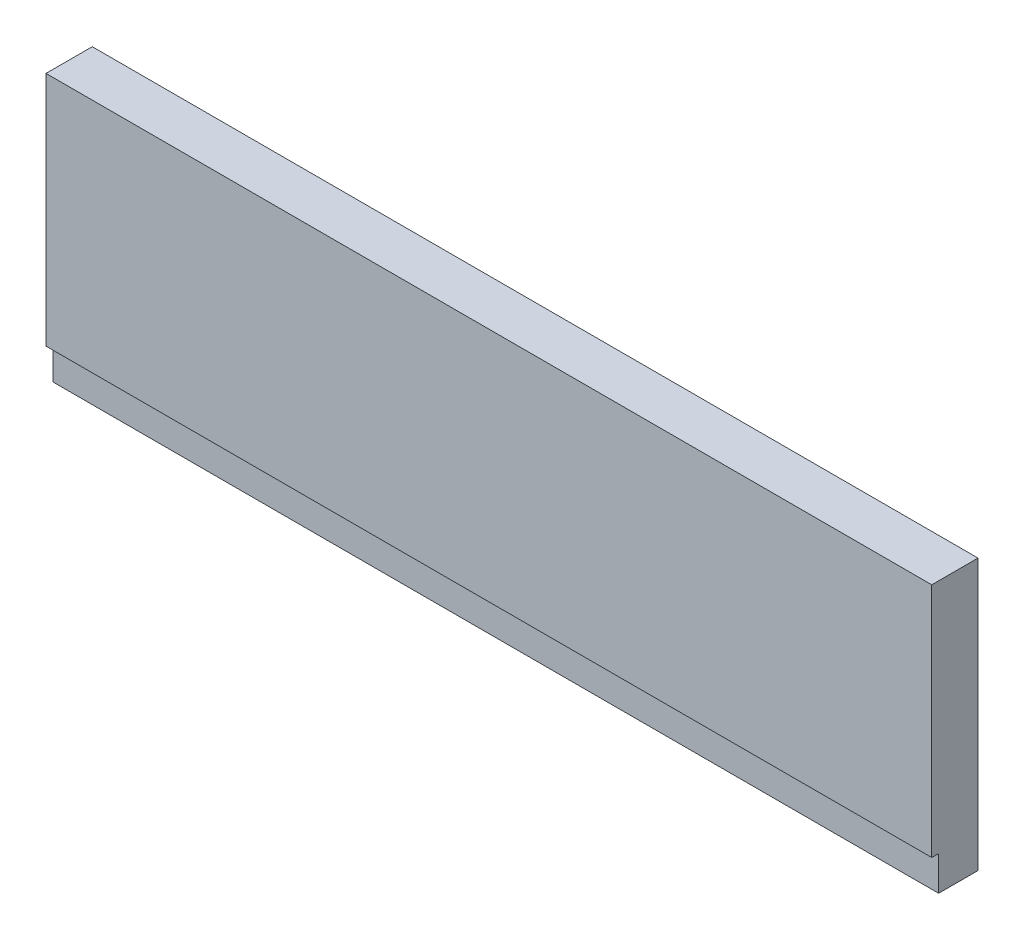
SolidWorks part; units mm, degrees
ref_plane "Спереди" through (0, 0, 0) normal (0, 0, 1) x (1, 0, 0)
ref_plane "Сверху" through (0, 0, 0) normal (0, 1, 0) x (1, 0, 0)
ref_plane "Справа" through (0, 0, 0) normal (1, 0, 0) x (0, 0, -1)
sketch "Эскиз1" plane through (0, 0, 0) normal (0, 0, 1) x (1, 0, 0)
  line L4 (-900, -1786.4608) -> (-900, -2026.4608)
  line L5 (0, -1786.4608) -> (0, -2026.4608)
  line L24 (0, -2026.4608) -> (-900, -2026.4608)
  line L39 (-900, -1786.4608) -> (0, -1786.4608)
extrude "Вытянуть1" add sketch "Эскиз1" along normal blind 47
sketch "Эскиз2" plane through (0, 0, 0) normal (0, 0, -1) x (-1, 0, 0)
  line L0 (0, -2026.4608) -> (0, -2061.4608)
  line L1 (900, -2026.4608) -> (900, -2061.4608)
  line L2 (900, -2061.4608) -> (0, -2061.4608)
  line L3 (900, -2026.4608) -> (0, -2026.4608) construction
  line L8 (900, -1786.4608) -> (0, -1786.4608)
  line L9 (0, -1786.4608) -> (0, -2026.4608)
  line L10 (0, -2026.4608) -> (900, -2026.4608)
  line L11 (900, -2026.4608) -> (900, -1786.4608)
  line L14 (0, -2026.4608) -> (900, -2026.4608)
  dimension "D1" = 35
  dimension "D2" = 0
extrude "Вытянуть2" add sketch "Эскиз2" against normal blind 40
